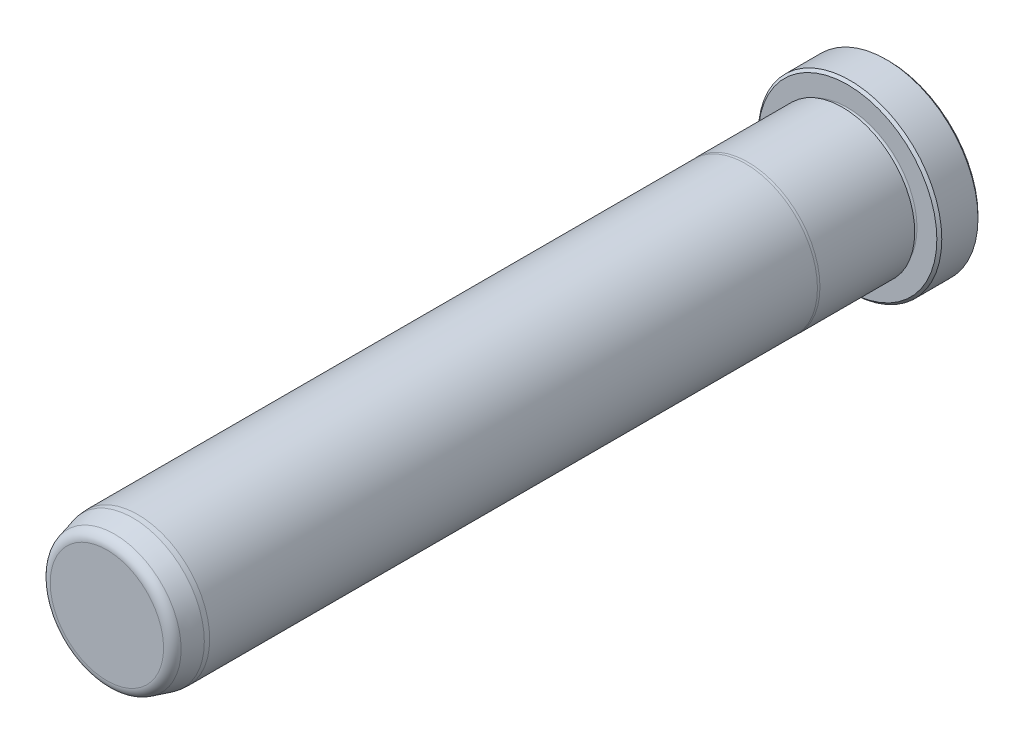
SolidWorks part; units mm, degrees
ref_plane "Front Plane" through (0, 0, 0) normal (0, 0, 1) x (1, 0, 0)
ref_plane "Top Plane" through (0, 0, 0) normal (0, 1, 0) x (1, 0, 0)
ref_plane "Right Plane" through (0, 0, 0) normal (1, 0, 0) x (0, 0, -1)
sketch "Sketch1" plane through (0, 0, 0) normal (1, 0, 0) x (0, 0, -1)
  line L0 (0, 0) -> (0, 14.1605)
  line L1 (0, 14.1605) -> (-6.35, 14.1605)
  line L2 (-6.35, 14.1605) -> (-6.35, 10.7188)
  line L3 (-6.35, 10.3378) -> (-7.112, 10.3378) construction
  line L4 (-7.112, 10.7188) -> (-7.112, 11.1252)
  line L5 (-7.112, 11.1252) -> (-21.7348, 11.1252)
  line L6 (-21.7348, 11.1252) -> (-22.098, 11.0998)
  line L7 (-22.098, 11.0998) -> (-115.8875, 11.0998)
  line L9 (-120.65, 9.9612) -> (-120.65, 0)
  line L10 (-120.65, 0) -> (0, 0)
  line L11 (0, 0) -> (13.6287, 0) construction
  line L12 (-115.8875, 11.0998) -> (-116.6495, 11.0331)
  line L13 (-116.6495, 11.0331) -> (-120.65, 9.9612)
  arc A0 (-7.112, 10.7188) -> (-6.35, 10.7188) centre (-6.731, 10.7188) ccw
  dimension "D14" = 0.762
  dimension "D1" = 6.35
  dimension "D2" = 0.762
  dimension "D3" = 28.321
  dimension "D4" = 22.2504
  dimension "D5" = 22.098
  dimension "D6" = 120.65
  dimension "D7" = 0.7874
  dimension "D8" = 4
  dimension "D9" = 22.1996
  dimension "D10" = 5
  dimension "D11" = 15
  dimension "D12" = 0.762
  dimension "D13" = 4.7625
revolve "Revolve1" add sketch "Sketch1" angle 360 about L11
fillet "Fillet6" radius 1.5875 1 edges at (9.9612, 0, 120.65)
chamfer "Chamfer1" distance 0.381 angle 45 2 edges at (14.1605, 0, 0) (14.1605, 0, 6.35)
